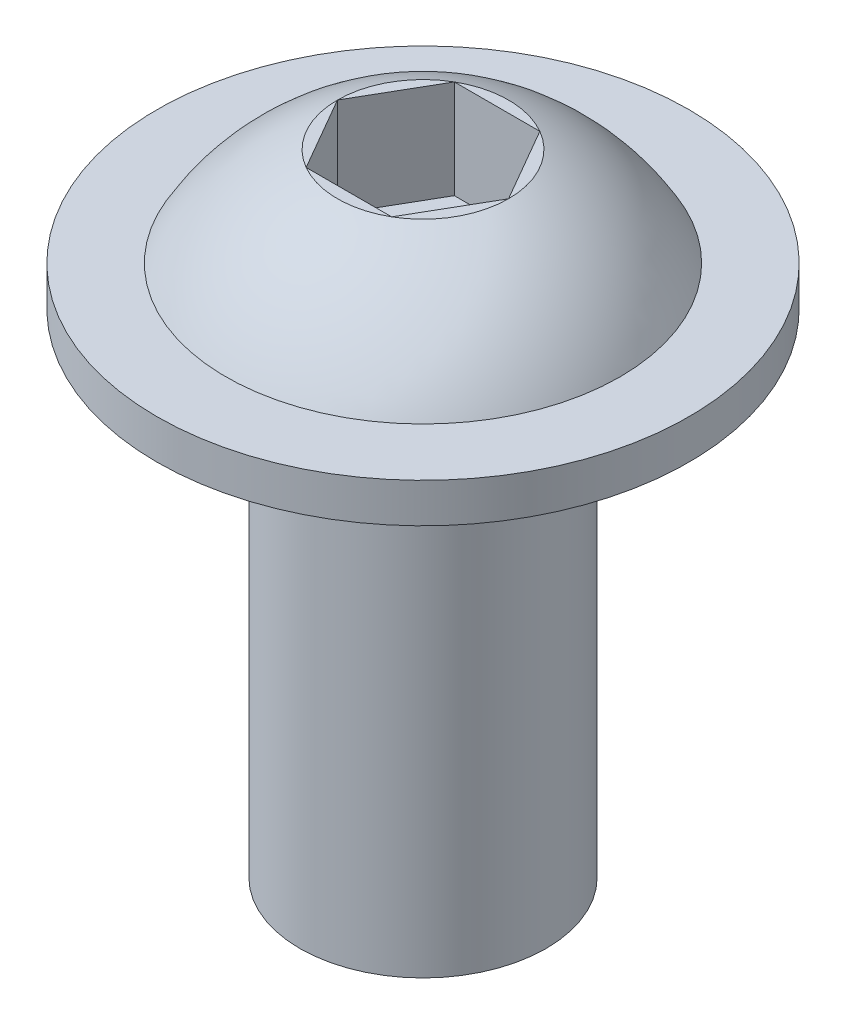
SolidWorks part; units mm, degrees
ref_plane "Front"
ref_plane "Top" through (0, 0, 0) normal (0, 1, 0) x (1, 0, 0)
ref_plane "Right" through (0, 0, 0) normal (1, 0, 0) x (0, 0, -1)
sketch "Sketch1" plane through (0, 0, 0) normal (0, 0, 1) x (1, 0, 0)
  line L0 (0, 0) -> (3.9688, 0)
  line L1 (3.9688, 0) -> (3.9688, 15.875)
  line L2 (3.9688, 15.875) -> (8.5725, 15.875)
  line L3 (8.5725, 15.875) -> (8.5725, 17.145)
  line L4 (8.5725, 17.145) -> (6.35, 17.145)
  line L5 (0, 0) -> (0, 20.32)
  line L6 (0, 0) -> (0, 30.7805) construction
  line L8 (2.757, 20.32) -> (0, 20.32)
  arc A0 (6.35, 17.145) -> (2.757, 20.32) centre (0, 13.5795) ccw
  dimension "MajorDia" = 7.9375
  dimension "D2" = 5.5139
  dimension "Length" = 15.875
  dimension "FlangeThick" = 1.27
  dimension "FlangeDiam" = 17.145
  dimension "HeadHeight" = 4.445
  dimension "HeadDiam" = 12.7
revolve "Screw revolve" add sketch "Sketch1" angle 360 about L6
sketch "Sketch2" plane through (0, 20.32, 0) normal (0, 1, 0) x (-1, 0, 0)
  line L1 (-2.757, 0) -> (-1.3785, -2.3876)
  line L2 (-1.3785, -2.3876) -> (1.3785, -2.3876)
  line L3 (1.3785, -2.3876) -> (2.757, 0)
  line L4 (2.757, 0) -> (1.3785, 2.3876)
  line L5 (1.3785, 2.3876) -> (-1.3785, 2.3876)
  line L6 (-1.3785, 2.3876) -> (-2.757, 0)
  circle A0 centre (0, 0) radius 2.3876 construction
  dimension "D1" = 5.5139
  dimension "HexWidth" = 4.7752
extrude "Hex Cut" cut sketch "Sketch2" against normal blind 3.175
equation "\"D2@Sketch1\" = \"D1@Sketch2\""
